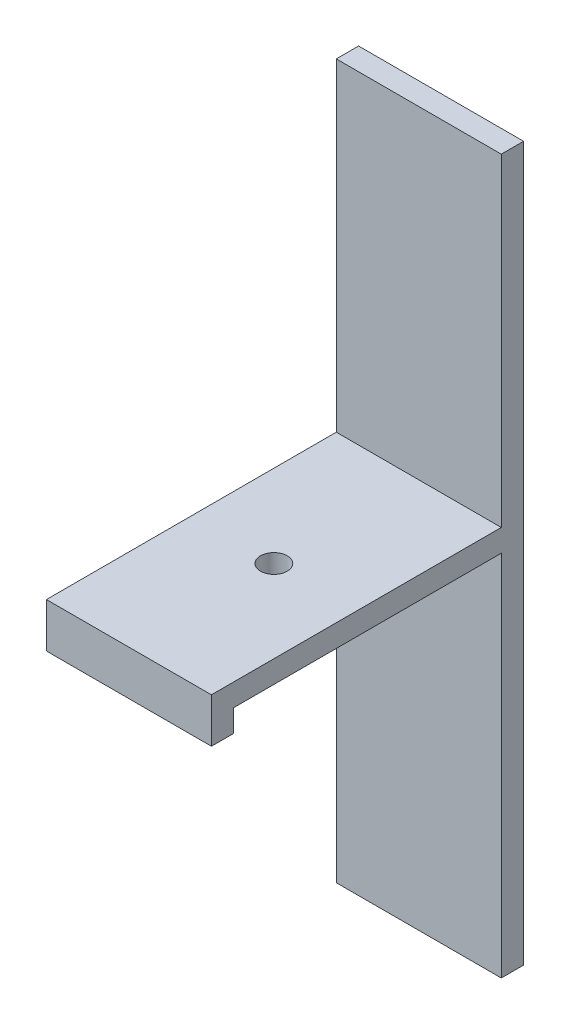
SolidWorks part; units mm, degrees
ref_plane "Front Plane" through (0, 0, 0) normal (0, 0, 1) x (1, 0, 0)
ref_plane "Top Plane" through (0, 0, 0) normal (0, 1, 0) x (1, 0, 0)
ref_plane "Right Plane" through (0, 0, 0) normal (1, 0, 0) x (0, 0, -1)
sketch "Sketch1" plane through (0, 0, 0) normal (0, 0, 1) x (1, 0, 0)
  line L1 (-37, 75) -> (0, 75)
  line L2 (-37, 75) -> (-37, -85)
  line L3 (-37, -85) -> (0, -85)
  line L4 (0, 75) -> (0, -85)
  line L5 (-37, 75) -> (0, -85) construction
  line L6 (-37, -85) -> (0, 75) construction
  point P0 (-18.5, -5)
  dimension "D1" = 160
  dimension "D2" = 37
extrude "Boss-Extrude1" add sketch "Sketch1" along normal blind 5
sketch "Sketch2" plane through (0, 0, 5) normal (0, 0, 1) x (1, 0, 0)
  line L0 (-18.5, 235) -> (-18.5, -85)
  line L2 (-37, -85) -> (0, -85) construction
  line L3 (0, 0) -> (-37, 0) construction
  line L4 (-37, 75) -> (-37, -85) construction
  line L5 (0, -85) -> (0, 75) construction
  line L6 (-37, 2.5) -> (0, 2.5)
  line L7 (-37, 2.5) -> (-37, -2.5)
  line L8 (-37, -2.5) -> (0, -2.5)
  line L9 (0, 2.5) -> (0, -2.5)
  line L10 (-37, 2.5) -> (0, -2.5) construction
  line L11 (-37, -2.5) -> (0, 2.5) construction
  point P7 (-18.5, 75)
  point P10 (-18.5, 0)
  dimension "D1" = 5
extrude "Boss-Extrude2" add sketch "Sketch2" along normal blind 65 contours L8 L9 L6 L7
sketch "Sketch3" plane through (0, 2.5, 0) normal (0, 1, 0) x (1, 0, 0)
  line L0 (0, -37.5) -> (-37, -37.5) construction
  line L1 (0, -70) -> (0, -5) construction
  line L2 (-37, -70) -> (-37, -5) construction
  line L3 (-18.5, -5) -> (-18.5, -70) construction
  line L4 (-37, -5) -> (0, -5) construction
  line L5 (-37, -70) -> (0, -70) construction
  circle A0 centre (-18.5, -37.5) radius 3
  dimension "D1" = 6
extrude "Cut-Extrude1" cut sketch "Sketch3" against normal blind 30
sketch "Sketch5" plane through (0, -2.5, 0) normal (0, -1, 0) x (1, 0, 0)
  line L0 (0, 70) -> (0, 5) construction
  line L1 (-37, 70) -> (0, 70)
  line L2 (-37, 70) -> (-37, 65)
  line L3 (-37, 65) -> (0, 65)
  line L4 (0, 70) -> (0, 65)
  dimension "D1" = 5
extrude "Boss-Extrude4" add sketch "Sketch5" along normal blind 5
